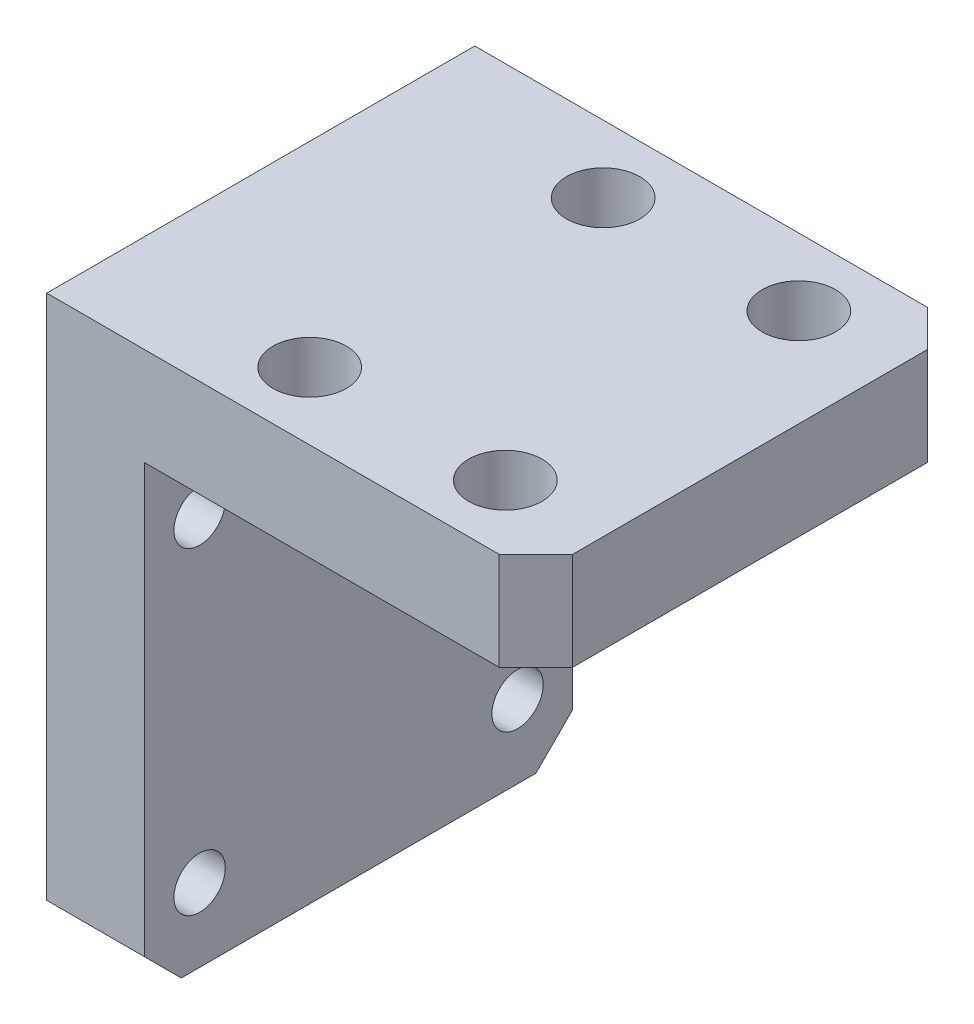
SolidWorks part; units mm, degrees
ref_plane "Спереди" through (0, 0, 0) normal (0, 0, 1) x (1, 0, 0)
ref_plane "Сверху" through (0, 0, 0) normal (0, 1, 0) x (1, 0, 0)
ref_plane "Справа" through (0, 0, 0) normal (1, 0, 0) x (0, 0, -1)
sketch "Эскиз2" plane through (0, 0, 0) normal (0, 0, 1) x (1, 0, 0)
  line L1 (-32, 0) -> (0, 0)
  line L3 (-40, 8) -> (0, 8)
  line L4 (0, 0) -> (0, 8)
  line L6 (-40, 8) -> (-40, -38)
  line L7 (-40, -38) -> (-32, -38)
  line L8 (-32, 0) -> (-32, -38)
  dimension "D1" = 8
  dimension "D2" = 40
  dimension "D3" = 8
  dimension "D4" = 38
extrude "Бобышка-Вытянуть2" add sketch "Эскиз2" along normal blind 35
sketch "Эскиз3" plane through (0, 8, 0) normal (0, 1, 0) x (1, 0, 0)
  line L1 (0, -35) -> (0, 0) construction
  line L3 (-32, -35) -> (-32, 0) construction
  line L4 (-140, -17.5) -> (120, -17.5) construction
  line L6 (-16, -50.4252) -> (-16, -18.536) construction
  circle A0 centre (-8, -29.5) radius 3
  circle A1 centre (-24, -29.5) radius 3
  circle A2 centre (-8, -5.5) radius 3
  circle A3 centre (-24, -5.5) radius 3
  point P4 (0, -17.5)
  dimension "D4" = 16
  dimension "D2" = 8
  dimension "D1" = 12
  dimension "D3" = 6
extrude "Вырез-Вытянуть1" cut sketch "Эскиз3" against normal through all
sketch "Esquisse1" plane through (-40, 0, 0) normal (-1, 0, 0) x (0, 0, 1)
  line L0 (17.5, 8) -> (17.5, -58.5196) construction
  line L1 (35, 8) -> (0, 8) construction
  line L3 (-3.48, -19) -> (64.9883, -19) construction
  line L4 (35, 0) -> (0, 0) construction
  circle A0 centre (4.5, -32) radius 2.1
  circle A1 centre (30.5, -32) radius 2.1
  circle A2 centre (30.5, -6) radius 2.1
  circle A3 centre (4.5, -6) radius 2.1
  dimension "D1" = 13
  dimension "D3" = 4.2
  dimension "D2" = 6
  dimension "D4" = 26
extrude "Enlèv. mat.-Extru.1" cut sketch "Esquisse1" against normal through all
chamfer "Chanfrein1" distance 3 angle 45 4 edges at (-36, -38, 0) (-36, -38, 35) (0, 4, 0) (0, 4, 35)
